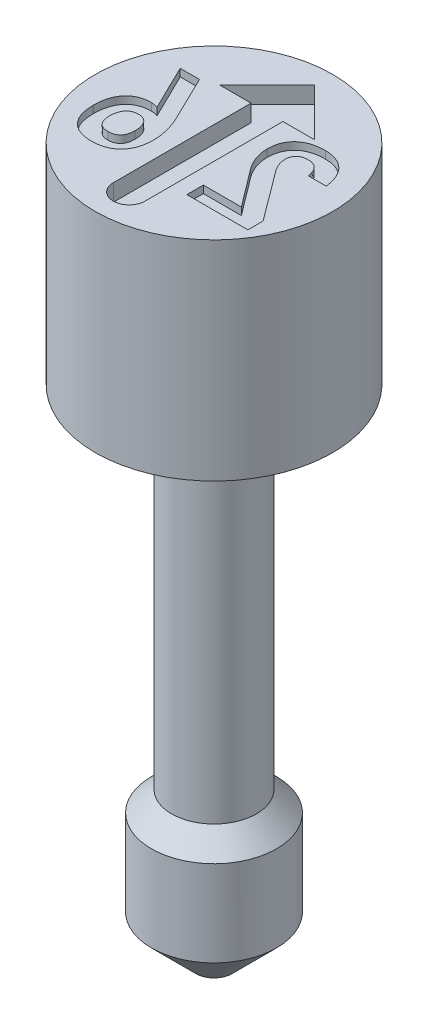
SolidWorks part; units mm, degrees
ref_plane "Front Plane" through (0, 0, 0) normal (0, 0, 1) x (1, 0, 0)
ref_plane "Top Plane" through (0, 0, 0) normal (0, 1, 0) x (1, 0, 0)
ref_plane "Right Plane" through (0, 0, 0) normal (1, 0, 0) x (0, 0, -1)
sketch "Sketch1" plane through (0, 0, 0) normal (0, 0, 1) x (1, 0, 0)
  line L0 (0, 17.018) -> (2.8448, 17.018)
  line L1 (0, -3.1293) -> (0, 3.1293) construction
  line L2 (2.8448, 17.018) -> (2.8448, 12.0142)
  line L3 (2.8448, 12.0142) -> (1.016, 12.0142)
  line L4 (1.016, 12.0142) -> (1.016, 3.6068)
  line L5 (1.016, 3.6068) -> (1.4986, 3.1242)
  line L6 (1.4986, 3.1242) -> (1.4986, 1.0668)
  line L7 (1.4986, 1.0668) -> (0.4318, 0)
  line L8 (3.1293, 0) -> (-3.1293, 0) construction
  line L9 (0.4318, 0) -> (0, 0)
  line L10 (0, 0) -> (0, 17.018)
  line L11 (0, 0) -> (0, 64.9194) construction
  dimension "D1" = 17.018
  dimension "D2" = 3.6068
  dimension "D3" = 1.0668
  dimension "D4" = 45
  dimension "D5" = 2.9972
  dimension "D6" = 5.6896
  dimension "D7" = 2.032
  dimension "D8" = 5.0038
revolve "Revolve1" add sketch "Sketch1" angle 360 about L11
sketch "Sketch2" plane through (0, 17.018, 0) normal (0, 1, 0) x (1, 0, 0)
  line L1 (0.381, -2.032) -> (0.381, 1.27)
  line L2 (-0.381, -2.032) -> (-0.381, 1.27)
  line L3 (0, -3.1293) -> (0, 3.1293) construction
  line L4 (-0.381, 1.27) -> (-1.143, 1.27)
  line L5 (0.381, 1.27) -> (1.143, 1.27)
  line L6 (1.143, 1.27) -> (0, 2.413)
  line L7 (0, 2.413) -> (-1.143, 1.27)
  line L8 (-3.1293, 0) -> (3.1293, 0) construction
  arc A0 (-0.381, -2.032) -> (0.381, -2.032) centre (0, -2.032) ccw
  dimension "D6" = 2.032
  dimension "D1" = 0.762
  dimension "D2" = 0.381
  dimension "D3" = 2.286
  dimension "D4" = 1.143
  dimension "D5" = 45
  dimension "D7" = 1.27
extrude "Cut-Extrude1" cut sketch "Sketch2" against normal blind 0.4064
sketch "Sketch3" plane through (0, 17.018, 0) normal (0, 1, 0) x (1, 0, 0)
  text T0 "2 6" font "Bahnschrift SemiBold" height 2.54
  dimension "D1" = 2.413
  dimension "D2" = 1.397
extrude "Cut-Extrude2" cut sketch "Sketch3" against normal blind 0.1778
